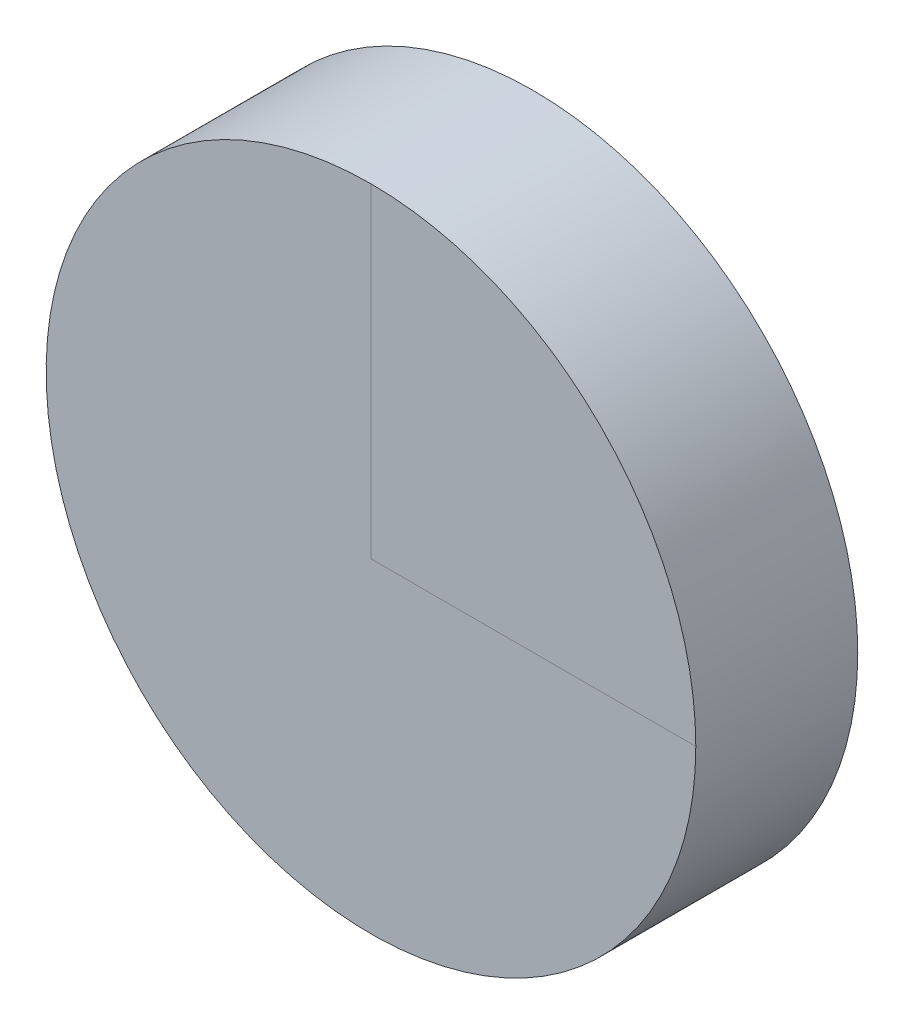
SolidWorks part; units mm, degrees
ref_plane "Front Plane" through (0, 0, 0) normal (0, 0, 1) x (1, 0, 0)
ref_plane "Top Plane" through (0, 0, 0) normal (0, 1, 0) x (1, 0, 0)
ref_plane "Right Plane" through (0, 0, 0) normal (1, 0, 0) x (0, 0, -1)
sketch "Sketch1" plane through (0, 0, 0) normal (0, 0, 1) x (1, 0, 0)
  circle A0 centre (0, 0) radius 200
  dimension "D1" = 400
extrude "Extrude1" add sketch "Sketch1" along normal blind 99.724
sketch "Sketch2" plane through (0, 0, 0) normal (0, 0, 1) x (1, 0, 0)
  line L0 (0, 0) -> (0, 200)
  line L1 (0, 0) -> (200, 0)
  circle A0 centre (0, 0) radius 200 construction
  arc A1 (200, 0) -> (0, 200) centre (0, 0) ccw
